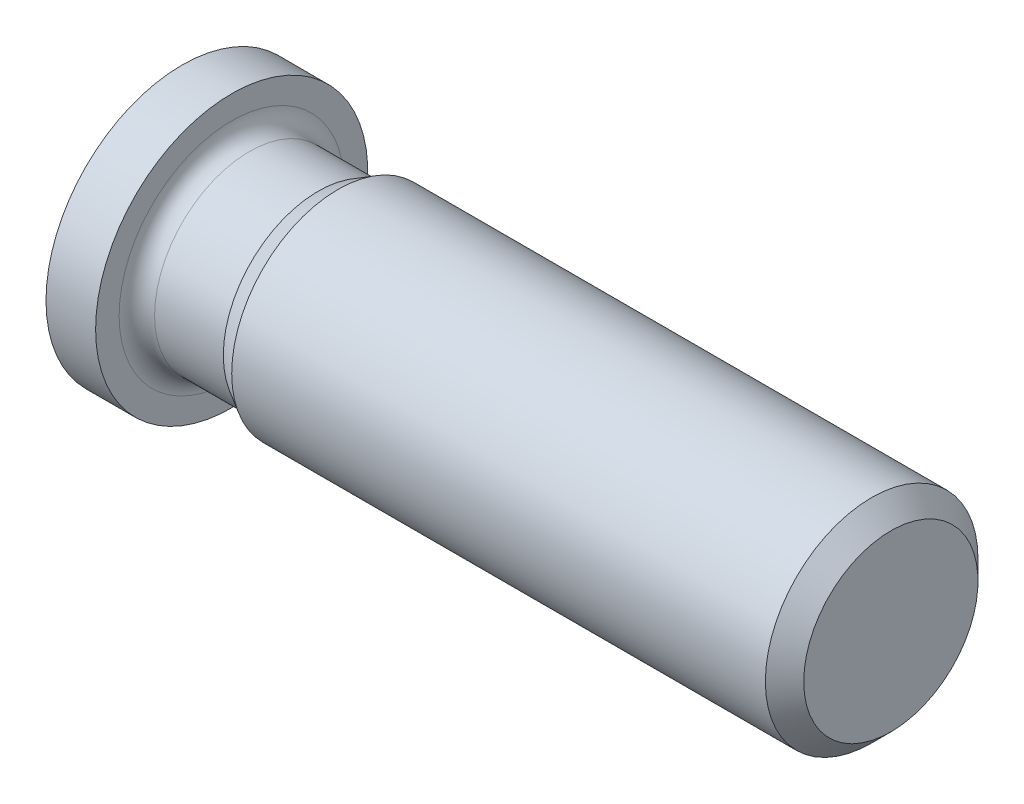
SolidWorks part; units mm, degrees
ref_plane "Front" through (0, 0, 0) normal (0, 0, 1) x (1, 0, 0)
ref_plane "Top" through (0, 0, 0) normal (0, 1, 0) x (1, 0, 0)
ref_plane "Right" through (0, 0, 0) normal (1, 0, 0) x (0, 0, -1)
sketch "Sketch1" plane through (0, 0, 0) normal (0, 0, 1) x (1, 0, 0)
  line L0 (0, 0) -> (22.7419, 0) construction
  line L1 (0, 0) -> (0, 0.44)
  line L2 (0, 0.44) -> (0.83, 0.9192)
  line L3 (0.83, 0.9192) -> (1.137, 3.84)
  line L4 (1.137, 3.84) -> (2.537, 3.84)
  line L5 (3.037, 3) -> (5.537, 3) construction
  line L6 (21.137, 3) -> (21.137, 0)
  line L7 (21.137, 0) -> (0, 0)
  line L8 (1.137, 3.84) -> (1.137, -8.0526) construction
  line L9 (2.537, 3.84) -> (2.537, 3.1765)
  line L10 (5.537, 3) -> (21.137, 3)
  line L11 (5.537, 3) -> (4.9767, 2.6765)
  line L12 (4.9767, 2.6765) -> (3.037, 2.6765)
  arc A0 (3.037, 2.6765) -> (2.537, 3.1765) centre (3.037, 3.1765) cw
  dimension "D5" = 0.5
  dimension "h" = 1.4
  dimension "a" = 3
  dimension "D3" = 6
  dimension "D4" = 30
  dimension "d1" = 7.68
  dimension "d2" = 0.88
  dimension "D6" = 5.353
  dimension "l" = 20
  dimension "l2" = 0.83
  dimension "d" = 6
revolve "Base" add sketch "Sketch1" angle 360 about L0
chamfer "EndChamfer" distance 0.5415 angle 45 1 edges at (21.137, 0, 3)
ref_plane "Plane1" through (4.037, 0, 0) normal (1, 0, 0) x (0, 0, -1)
sketch "Sketch2" plane through (0, 0, 0) normal (0, 0, 1) x (1, 0, 0)
  line L0 (20.5955, 2.531) -> (20.8662, 3)
  line L1 (20.8662, 3) -> (20.8662, 3.5)
  line L2 (20.8662, 3.5) -> (20.3247, 3.5)
  line L3 (20.3247, 3.5) -> (20.3247, 3)
  line L4 (20.3247, 3) -> (20.5955, 2.531)
  line L5 (0, 0) -> (22.4926, 0) construction
  line L7 (20.5955, 3) -> (20.5955, -3) construction
  dimension "D1" = 60
  dimension "D2" = 60
  dimension "D3" = 0.5
  dimension "D4" = 0.5415
  dimension "D5" = 6
revolve "Cut-Revolve10" [suppressed] cut sketch "Sketch2" angle 360 about L5
pattern_linear "LPattern10" [suppressed] count 24 spacing 0.6498 along (1, 0, 0)
equation "\"D1@ThreadCosmetic1\" = \"l@Sketch1\" - \"h@Sketch1\" -\"a@Sketch1\""
equation "\"D1@EndChamfer\" =  ( \"d@Sketch1\" - \"D2@ThreadCosmetic1\" )  / 2"
equation "\"D5@Sketch2\" = \"d@Sketch1\""
equation "\"D4@Sketch2\" = (  \"d@Sketch1\" - \"D2@ThreadCosmetic1\" )  / 2"
equation "\"D3@LPattern10\" = \"D4@Sketch2\" * 1.2"
equation "\"D1@LPattern10\" = \"D1@ThreadCosmetic1\" / \"D3@LPattern10\""
